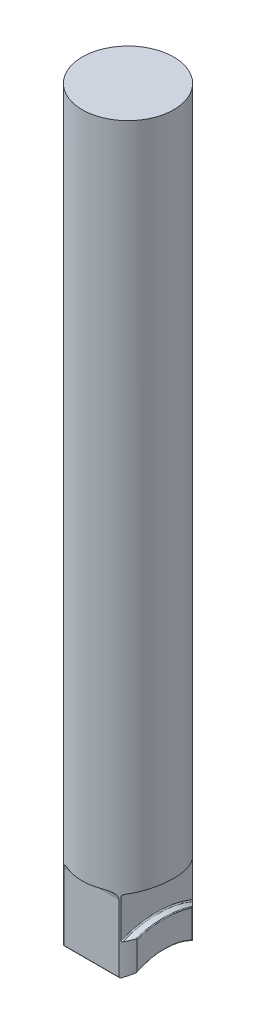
SolidWorks part; units mm, degrees
ref_plane "Front Plane" through (0, 0, 0) normal (0, 0, 1) x (1, 0, 0)
ref_plane "Top Plane" through (0, 0, 0) normal (0, 1, 0) x (1, 0, 0)
ref_plane "Right Plane" through (0, 0, 0) normal (1, 0, 0) x (0, 0, -1)
sketch "Sketch1" plane through (0, 0, 0) normal (1, 0, 0) x (0, 0, -1)
  line L0 (-15.875, 276.225) -> (-15.875, 0)
  line L1 (0, 249.2329) -> (0, 0) construction
  line L2 (15.875, 276.225) -> (15.875, 0)
  line L3 (-15.875, 276.225) -> (15.875, 276.225)
  line L6 (-15.875, 0) -> (15.875, 0)
  arc A0 (-22.225, 0) -> (22.225, 0) centre (0, 0) cw construction
  dimension "R" = 22.225
  dimension "L" = 254
  dimension "T" = 31.75
extrude "Boss-Extrude1" add sketch "Sketch1" along normal mid plane 31.75
sketch "Sketch8" plane through (0, 0, 0) normal (1, 0, 0) x (0, 0, -1)
  circle A0 centre (0, 0) radius 22.225
  arc A1 (22.225, 0) -> (-22.225, 0) centre (0, 0) ccw construction
extrude "Cut-Extrude4" cut sketch "Sketch8" against normal through all both and the other way through all
sketch "Sketch2" plane through (0, 0, 0) normal (0, 0, 1) x (1, 0, 0)
  line L0 (15.875, 31.75) -> (9.906, 31.75)
  line L1 (15.875, 276.225) -> (15.875, 15.5543) construction
  line L2 (9.906, 31.75) -> (9.906, 45.212)
  line L3 (9.906, 45.212) -> (15.875, 45.212)
  line L4 (15.875, 45.212) -> (15.875, 31.75)
  line L5 (0, 29.9173) -> (0, 0) construction
  line L6 (-15.875, 45.212) -> (-15.875, 31.75)
  line L7 (-9.906, 45.212) -> (-15.875, 45.212)
  line L8 (-9.906, 31.75) -> (-9.906, 45.212)
  line L9 (-15.875, 31.75) -> (-9.906, 31.75)
  line L10 (-8.8482, 0) -> (24.5305, 0) construction
  dimension "D1" = 19.812
  dimension "D2" = 45.212
  dimension "D3" = 31.75
revolve "Cut-Revolve1" cut sketch "Sketch2" angle 360 about L10
sketch "Sketch6" plane through (0, 0, 0) normal (1, 0, 0) x (0, 0, -1)
  line L0 (0, 19.903) -> (0, 0) construction
  line L1 (12.7, 0) -> (31.75, 0)
  line L2 (12.7, 0) -> (12.7, 42.037)
  line L3 (15.0876, 44.4246) -> (31.75, 44.4246)
  line L4 (31.75, 0) -> (31.75, 44.4246)
  line L9 (-12.7, 0) -> (-31.75, 0)
  line L10 (-31.75, 0) -> (-31.75, 44.4246)
  line L11 (-15.0876, 44.4246) -> (-31.75, 44.4246)
  line L12 (-12.7, 0) -> (-12.7, 42.037)
  arc A0 (12.7, 42.037) -> (15.0876, 44.4246) centre (15.0876, 42.037) cw
  arc A1 (-12.7, 42.037) -> (-15.0876, 44.4246) centre (-15.0876, 42.037) ccw
  arc A4 (15.875, 15.5543) -> (-15.875, 15.5543) centre (0, 0) ccw construction
  dimension "D3" = 2.3876
  dimension "MT" = 25.4
  dimension "D2" = 19.05
  dimension "D4" = 19.812
extrude "Cut-Extrude2" cut sketch "Sketch6" against normal through all both and the other way through all
sketch "Sketch7" plane through (0, 0, 0) normal (0, 0, 1) x (1, 0, 0)
  line L6 (-15.875, 31.75) -> (-12.7, 31.75)
  line L8 (-15.875, 31.75) -> (-15.875, 0)
  line L9 (-15.875, 0) -> (-12.7, 0)
  line L10 (-12.7, 31.75) -> (-12.7, 0)
  line L11 (0, 16.5651) -> (0, 5.9342) construction
  line L12 (12.7, 31.75) -> (12.7, 0)
  line L13 (15.875, 0) -> (12.7, 0)
  line L14 (15.875, 31.75) -> (15.875, 0)
  line L15 (15.875, 31.75) -> (12.7, 31.75)
  dimension "MW" = 25.4
extrude "Cut-Extrude3" cut sketch "Sketch7" against normal through all both and the other way through all
fillet "Fillet1" radius 0.762 2 edges at (-9.906, 45.212, 0) (9.906, 45.212, 0)
fillet "Fillet2" radius 0.381 2 edges at (-9.906, 31.75, 0) (9.906, 31.75, 0)
fillet "Fillet3" radius 0.254 10 edges at (12.7, 23.6692, -12.7) (12.7, 23.6692, 12.7) (12.7, 31.75, 0) (-12.7, 23.6692, 12.7) (-12.7, 23.6692, -12.7) (-12.7, 31.75, 0) (12.7, 22.225, 0) (-12.7, 22.225, 0) (0, 18.239, -12.7) (0, 18.239, 12.7)
sketch "Sketch9" plane through (0, 276.225, 0) normal (0, 1, 0) x (1, 0, 0)
  circle A0 centre (0, 0) radius 15.875
  dimension "D1" = 31.75
extrude "Cut-Extrude5" cut sketch "Sketch9" against normal through all flip side to cut
